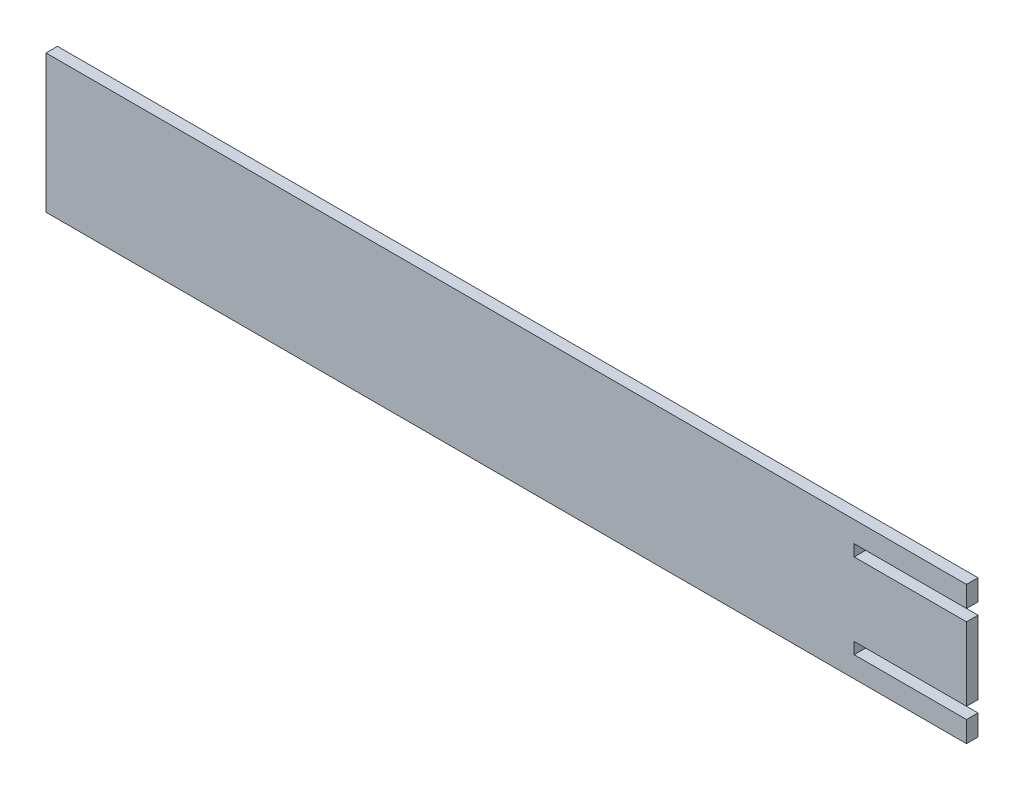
SolidWorks part; units mm, degrees
ref_plane "Front Plane" through (0, 0, 0) normal (0, 0, 1) x (1, 0, 0)
ref_plane "Top Plane" through (0, 0, 0) normal (0, 1, 0) x (1, 0, 0)
ref_plane "Right Plane" through (0, 0, 0) normal (1, 0, 0) x (0, 0, -1)
sketch "Sketch1" plane through (0, 0, 0) normal (0, 0, 1) x (1, 0, 0)
  line L17 (0, 110.0805) -> (0, 176.0805)
  line L18 (0, 176.0805) -> (440.34, 176.0805)
  line L19 (440.34, 176.0805) -> (440.34, 166.0805)
  line L20 (440.34, 166.0805) -> (386.59, 166.0805)
  line L21 (386.59, 166.0805) -> (386.59, 160.5805)
  line L22 (386.59, 160.5805) -> (440.34, 160.5805)
  line L23 (440.34, 160.5805) -> (440.34, 125.5805)
  line L24 (440.34, 125.5805) -> (386.59, 125.5805)
  line L25 (386.59, 125.5805) -> (386.59, 120.0805)
  line L26 (386.59, 120.0805) -> (440.34, 120.0805)
  line L27 (440.34, 120.0805) -> (440.34, 110.0805)
  line L28 (440.34, 110.0805) -> (0, 110.0805)
extrude "Boss-Extrude1" add sketch "Sketch1" along normal blind 5.5
